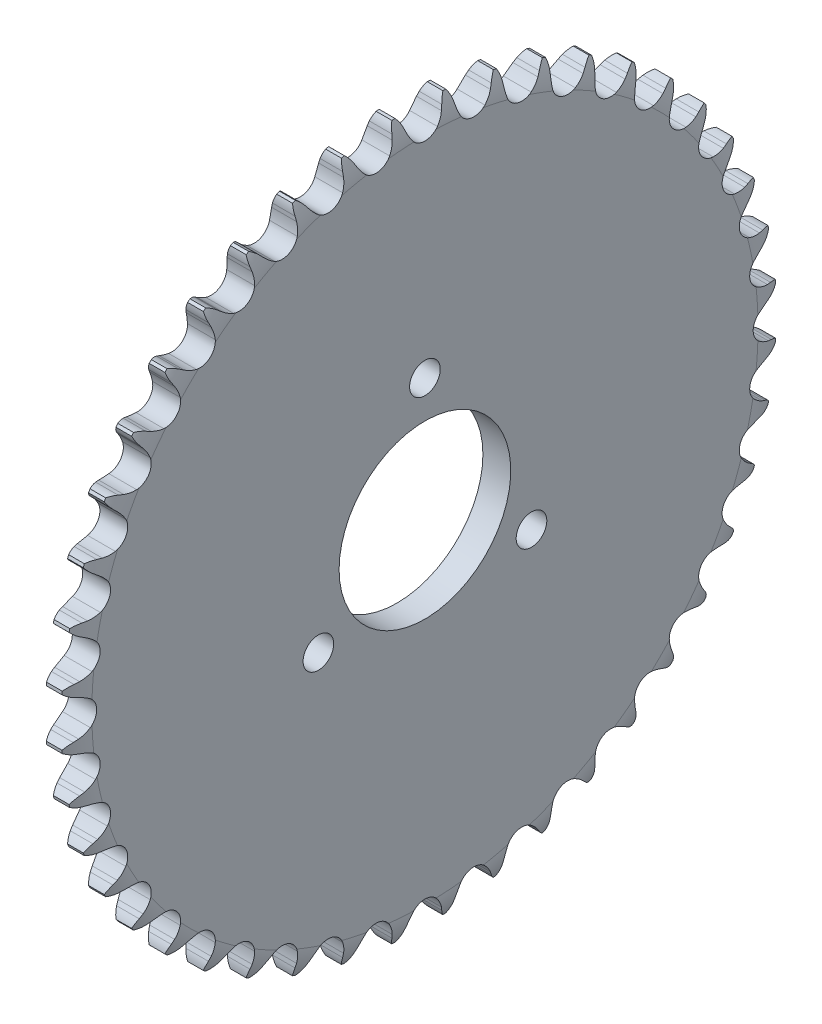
SolidWorks part; units mm, degrees
ref_plane "Plane1" through (0, 0, 0) normal (0, 0, 1) x (1, 0, 0)
ref_plane "Plane2" through (0, 0, 0) normal (0, 1, 0) x (1, 0, 0)
ref_plane "Plane3" through (0, 0, 0) normal (1, 0, 0) x (0, 0, -1)
sketch "Clipboard" plane through (0, 0, 0) normal (0, 1, 0) x (1, 0, 0)
  line L0 (0, 0) -> (9.1356, -8.8222)
  line L1 (-15, 0) -> (100, 0) construction
  line L2 (0, 0) -> (-1.0435, 1.1794)
  line L3 (0, 0) -> (-5.9315, 2.2671)
  line L4 (0, 0) -> (5.7006, 5.505)
  line L5 (0, 0) -> (-47.5972, -17.7524)
  line L6 (0, 0) -> (-5.9832, -4.0369)
  line L7 (-1.0435, 1.1794) -> (34.8775, 37.1005)
  line L8 (-76.2, 38.1) -> (-60.3758, 38.1)
  line L9 (-73.2057, 38.5609) -> (-73.0533, 38.5634)
  line L10 (-73.0533, 76.1892) -> (-58.6769, 76.1892)
  circle A0 centre (0, 0) radius 3.9624
  circle A1 centre (0, 0) radius 38.1
  circle A2 centre (0, 0) radius 38.1
  dimension "Dr" = 7.9248
  dimension "MHD" = 76.2
  dimension "Hub_dia" = 76.2
  dimension "Num_teeth" = 44
  dimension "Pitch" = 12.7
  dimension "Width" = 7.9248
  dimension "Chamfer_wid" = 1.5748
  dimension "Chamfer_dep" = 6.35
  dimension "Overall_len" = 50.8
  dimension "Show_teeth" = 44
  dimension "Thickness" = 7.2177
  dimension "OAL" = 50.8001
  dimension "T_dim" = 15.8242
  dimension "Width_const" = 0.1524
  dimension "Width_factor" = 0.93
  dimension "Num_strands" = 1
  dimension "Transv_pitch" = 14.3764
sketch "BasProSke" plane through (0, 0, 0) normal (0, 1, 0) x (1, 0, 0)
  line L0 (-10, 0) -> (60, 0) construction
  line L1 (0, 0) -> (0, 86.2446)
  line L2 (0, 0) -> (7.2177, 0)
  line L3 (7.2177, 0) -> (7.2177, 86.2446)
  line L4 (5.6429, 92.5946) -> (1.5748, 92.5946)
  arc A0 (0, 86.2446) -> (1.5748, 92.5946) centre (13.5898, 86.2446) cw
  arc A1 (7.2177, 86.2446) -> (5.6429, 92.5946) centre (-6.3722, 86.2446) ccw
  dimension "D1" = 13.5898
  dimension "G1" = 1.5748
  dimension "G2" = 1.5748
  dimension "H2" = 6.35
  dimension "Diameter" = 185.1892
  dimension "H1" = 6.35
  dimension "Thickness" = 7.2177
revolve "Base-Revolve" add sketch "BasProSke" angle 360 about L0
sketch "GrvSke" plane through (0, 0, 0) normal (0, 1, 0) x (1, 0, 0)
  line L0 (7.2177, 86.2446) -> (7.2177, 82.0536)
  line L1 (7.2177, 82.0536) -> (14.3764, 82.0536)
  line L2 (14.3764, 82.0536) -> (14.3764, 86.2446)
  line L3 (5.6429, 92.5946) -> (15.9512, 92.5946)
  line L4 (10.797, 0) -> (10.797, 52.07) construction
  line L5 (-10, 0) -> (60, 0) construction
  line L6 (0, 0) -> (35.56, 0) construction
  arc A0 (14.3764, 86.2446) -> (15.9512, 92.5946) centre (27.9662, 86.2446) cw
  arc A1 (7.2177, 86.2446) -> (5.6429, 92.5946) centre (-6.3722, 86.2446) ccw
  dimension "Diameter" = 185.1892
  dimension "H1" = 6.35
  dimension "Grv_diam" = 164.1072
  dimension "Grv_width" = 7.1587
  dimension "Offset" = 10.797
  dimension "G1" = 1.5748
revolve "Groove" [suppressed] cut sketch "GrvSke" angle 360 about L6
pattern_linear "Grooves" [suppressed]
sketch "TooCutSke" plane through (0, 0, 0) normal (1, 0, 0) x (0, 0, -1)
  line L0 (4.6524, 89.2888) -> (5.0384, 90.3707)
  line L1 (0, 0) -> (0, 107) construction
  line L2 (0, 89.0114) -> (-10, 89.0114) construction
  line L3 (-4.6524, 89.2888) -> (-5.0384, 90.3707)
  arc A0 (3.2374, 86.6277) -> (4.6524, 89.2888) centre (-5.1053, 92.7703) ccw
  arc A1 (3.2374, 86.6277) -> (-3.2374, 86.6277) centre (0, 89.0114) cw
  arc A2 (5.0384, 90.3707) -> (11.0665, 94.6202) centre (11.0665, 88.2199) cw
  arc A3 (-3.2374, 86.6277) -> (-4.6524, 89.2888) centre (5.1053, 92.7703) cw
  arc A4 (-5.0384, 90.3707) -> (-11.0665, 94.6202) centre (-11.0665, 88.2199) ccw
  arc A5 (11.0665, 94.6202) -> (-11.0665, 94.6202) centre (0, 0) ccw
  dimension "R" = 4.0203
  dimension "E" = 10.3602
  dimension "F" = 6.4003
  dimension "Pitch_radius" = 89.0114
  dimension "W" = 11.0665
  dimension "V" = 0.7915
  dimension "A" = 36.364
  dimension "B" = 16.727
extrude "ToothCut" cut sketch "TooCutSke" along normal through all
pattern_circular "TeethCuts" count 44 every 8.182 about axis through (-10, 0, 0) along (1, 0, 0) of "ToothCut"
sketch "HubNeaOneSke" plane through (0, 0, 0) normal (-1, 0, 0) x (0, 0, 1)
  circle A0 centre (0, 0) radius 38.1
  dimension "Diameter" = 76.2
extrude "HubNearOne" [suppressed] add sketch "HubNeaOneSke" along normal blind 43.5824
sketch "HubNeaBotSke" plane through (0, 0, 0) normal (-1, 0, 0) x (0, 0, 1)
  circle A0 centre (0, 0) radius 38.1
  dimension "Diameter" = 76.2
extrude "HubNearBoth" [suppressed] add sketch "HubNeaBotSke" along normal blind 21.7912
ref_plane "FarPln" through (7.2177, 0, 0) normal (1, 0, 0) x (0, 0, -1)
sketch "HubFarSke" plane through (7.2177, 0, 0) normal (1, 0, 0) x (0, 0, -1)
  circle A0 centre (0, 0) radius 38.1
  dimension "Diameter" = 76.2
extrude "HubFar" [suppressed] add sketch "HubFarSke" along normal blind 21.7912
sketch "BorSke" plane through (0, 0, 0) normal (1, 0, 0) x (0, 0, -1)
  line L0 (0, 0) -> (0, 31.8516) construction
  line L1 (0, 0) -> (27.5843, -15.9258) construction
  line L2 (0, 0) -> (-27.5843, -15.9258) construction
  circle A0 centre (0, 0) radius 22.225
  circle A1 centre (0, 31.8516) radius 3.9624
  circle A2 centre (-27.5843, -15.9258) radius 3.9624
  circle A3 centre (27.5843, -15.9258) radius 3.9624
  dimension "D1" = 120
  dimension "Diameter" = 44.45
  dimension "D4" = 7.9248
  dimension "D2" = 120
  dimension "D3" = 31.8516
extrude "Bore" cut sketch "BorSke" along normal mid plane 101.6001
sketch "KeySke" plane through (0, 0, 0) normal (1, 0, 0) x (0, 0, -1)
  line L0 (-1.5875, 0) -> (-1.5875, 6.4008)
  line L1 (-1.5875, 6.4008) -> (1.5875, 6.4008)
  line L2 (1.5875, 6.4008) -> (1.5875, 0)
  line L3 (0, 0) -> (0, 34) construction
  line L4 (-1.5875, 0) -> (1.5875, 0)
  dimension "Offset" = 6.4008
  dimension "Width" = 3.175
extrude "Keyway" [suppressed] cut sketch "KeySke" along normal mid plane 101.6001
pattern_circular "Keyway2" [suppressed] count 2 every 90 about axis through (-10, 0, 0) along (1, 0, 0)
equation "\"Num_teeth@Clipboard\" = int( \"Num_teeth@Clipboard\" )"
equation "\"Num_teeth@Clipboard\" = ((sgn( \"Num_teeth@Clipboard\" - 5.0)+1)*( \"Num_teeth@Clipboard\" - 5.0))/2 +5.0"
equation "\"Num_teeth@Clipboard\" = ((sgn( \"Num_teeth@Clipboard\" - 200.0)-1)*( \"Num_teeth@Clipboard\" - 200.0))/-2 +200.0"
equation "\"MHD@Clipboard\" = \"Pitch@Clipboard\" * (1.0 / tan(3.14159265 / \"Num_teeth@Clipboard\" ) - 1.0) - 0.03"
equation "\"Thickness@Clipboard\"  = \"Width@Clipboard\" * \"Width_factor@Clipboard\" - \"Width_const@Clipboard\" + (\"Num_strands@Clipboard\" - 1) * \"Transv_pitch@Clipboard\""
equation "\"OAL@Clipboard\" = \"Thickness@Clipboard\""
equation "\"MHD@Clipboard\" = ((sgn( \"MHD@Clipboard\" - \"Hub_dia@Clipboard\" )-1)*( \"MHD@Clipboard\" - \"Hub_dia@Clipboard\" ))/-2+ \"Hub_dia@Clipboard\""
equation "\"OAL@Clipboard\" = ((sgn( \"OAL@Clipboard\" - \"Overall_len@Clipboard\" )+1)*( \"OAL@Clipboard\" - \"Overall_len@Clipboard\" ))/2 + \"Overall_len@Clipboard\" + 0.000002"
equation "\"Num_teeth@TeethCuts\" = int( \"Show_teeth@Clipboard\" ) + 1"
equation "\"Num_teeth@TeethCuts\" = ((sgn( \"Num_teeth@TeethCuts\" - \"Num_teeth@Clipboard\" )-1)*( \"Num_teeth@TeethCuts\" - \"Num_teeth@Clipboard\" ))/-2+ \"Num_teeth@Clipboard\""
equation "\"Num_teeth@TeethCuts\" = ((sgn( \"Num_teeth@TeethCuts\" - 2.0)+1)*( \"Num_teeth@TeethCuts\" - 2.0))/2 +2.0"
equation "\"Angle@TeethCuts\" = 360.0 / \"Num_teeth@Clipboard\""
equation "\"Pitch_radius@TooCutSke\" = ( \"Pitch@Clipboard\" / 2.0) / sin(3.14159265 / \"Num_teeth@Clipboard\" )  'ma"
equation "\"R@TooCutSke\"  = \"Dr@Clipboard\" * 0.5025 + 0.0015"
equation "\"A@TooCutSke\" = 35.0 + (60.0 / \"Num_teeth@Clipboard\")"
equation "\"E@TooCutSke\"  = \"Dr@Clipboard\" * 1.3025 + 0.0015"
equation "\"B@TooCutSke\"  = 18.0 - (56.0 / \"Num_teeth@Clipboard\" )"
equation "\"W@TooCutSke\" = 1.4 * \"Dr@Clipboard\" * cos(3.14159265 / \"Num_teeth@Clipboard\" )"
equation "\"V@TooCutSke\" = 1.4 * \"Dr@Clipboard\" * sin(3.14159265 / \"Num_teeth@Clipboard\" )"
equation "\"Diameter@BasProSke\" = 2.0 * ( (0.3 * \"Pitch@Clipboard\" ) +  \"Pitch@Clipboard\" / 2.0 / tan(3.14159265 / \"Num_teeth@Clipboard\" ))"
equation "\"Thickness@BasProSke\"  = \"Thickness@Clipboard\""
equation "\"G1@BasProSke\" =  \"Chamfer_wid@Clipboard\""
equation "\"G2@BasProSke\" =  \"Chamfer_wid@Clipboard\""
equation "\"H1@BasProSke\" =  \"Chamfer_dep@Clipboard\""
equation "\"H2@BasProSke\" =  \"Chamfer_dep@Clipboard\""
equation "\"Diameter@GrvSke\" = \"Diameter@BasProSke\""
equation "\"G1@GrvSke\" = \"Chamfer_wid@Clipboard\""
equation "\"H1@GrvSke\" = \"Chamfer_dep@Clipboard\""
equation "\"Grv_diam@GrvSke\" =  \"Pitch@Clipboard\" * (1.0 / tan(3.14159265 / \"Num_teeth@Clipboard\" ) - 1.0) - 0.03"
equation "\"Grv_width@GrvSke\" =  \"Transv_pitch@Clipboard\" - ( \"Width@Clipboard\" * \"Width_factor@Clipboard\" - \"Width_const@Clipboard\" )"
equation "\"Offset@GrvSke\" = \"Grv_width@GrvSke\" / 2.0 + ( \"Width@Clipboard\" * \"Width_factor@Clipboard\" - \"Width_const@Clipboard\" )"
equation "\"Offset@Grooves\" = \"Transv_pitch@Clipboard\""
equation "\"Num_grvs@Grooves\" = \"Num_strands@Clipboard\""
equation "\"Num_grvs@Grooves\" = \"Num_grvs@Grooves\" - 1 * sgn( \"Num_grvs@Grooves\" -1)"
equation "\"Diameter@HubNeaOneSke\" = \"MHD@Clipboard\""
equation "\"Length@HubNearOne\" = \"OAL@Clipboard\" - \"Thickness@BasProSke\""
equation "\"Diameter@HubNeaBotSke\" = \"MHD@Clipboard\""
equation "\"Length@HubNearBoth\" = ( \"OAL@Clipboard\" - \"Thickness@BasProSke\" ) / 2.0"
equation "\"Thickness@FarPln\" = \"Thickness@BasProSke\""
equation "\"Diameter@HubFarSke\" = \"MHD@Clipboard\""
equation "\"Length@HubFar\" = ( \"OAL@Clipboard\" - \"Thickness@BasProSke\" ) / 2.0"
equation "\"D1@Bore\" = \"OAL@Clipboard\" * 2.0"
equation "\"D1@Keyway\" = \"OAL@Clipboard\" * 2.0"
equation "\"Offset@KeySke\" = \"T_dim@Clipboard\" - \"Diameter@BorSke\" / 2.0"
